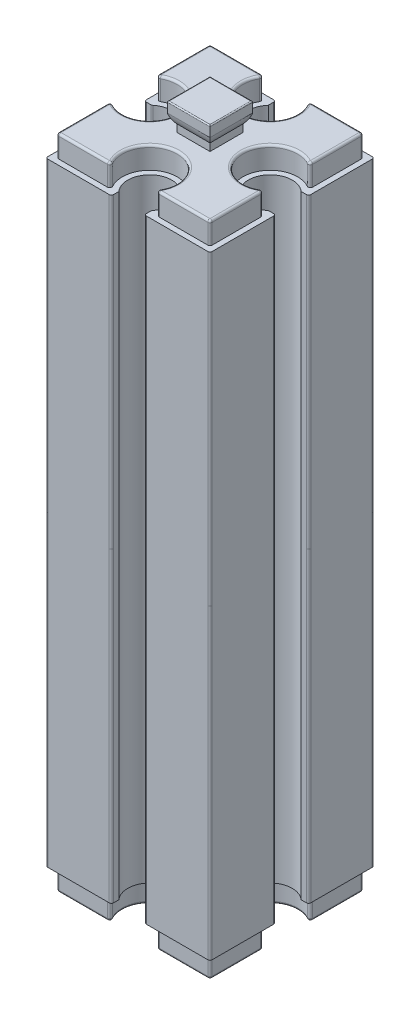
SolidWorks part; units mm, degrees
ref_plane "前视基准面" through (0, 0, 0) normal (0, 0, 1) x (1, 0, 0)
ref_plane "上视基准面" through (0, 0, 0) normal (0, 1, 0) x (1, 0, 0)
ref_plane "右视基准面" through (0, 0, 0) normal (1, 0, 0) x (0, 0, -1)
sketch "草图1" plane through (0, 0, 0) normal (0, 1, 0) x (1, 0, 0)
  line L0 (0, 0) -> (0, 7.5) construction
  line L1 (0, 0) -> (7.5, 0) construction
  line L2 (-7.5, 7.5) -> (-1.5, 7.5)
  line L3 (7.5, 7.5) -> (7.5, 1.5)
  line L4 (6.8229, 1.5) -> (7.5, 1.5)
  line L5 (6.8229, -1.5) -> (7.5, -1.5)
  line L6 (0, 7.5) -> (0, 5.5) construction
  line L7 (-1.5, 6.8229) -> (-1.5, 7.5)
  line L8 (1.5, 6.8229) -> (1.5, 7.5)
  line L9 (1.5, 7.5) -> (7.5, 7.5)
  line L10 (7.5, -1.5) -> (7.5, -7.5)
  line L11 (7.5, -7.5) -> (1.5, -7.5)
  line L12 (1.5, -6.8229) -> (1.5, -7.5)
  line L13 (-1.5, -6.8229) -> (-1.5, -7.5)
  line L14 (-1.5, -7.5) -> (-7.5, -7.5)
  line L15 (-7.5, -7.5) -> (-7.5, -1.5)
  line L16 (-6.8229, -1.5) -> (-7.5, -1.5)
  line L17 (-6.8229, 1.5) -> (-7.5, 1.5)
  line L18 (-7.5, 1.5) -> (-7.5, 7.5)
  arc A0 (-1.5, 6.8229) -> (1.5, 6.8229) centre (0, 5.5) ccw
  arc A1 (6.8229, 1.5) -> (6.8229, -1.5) centre (5.5, 0) ccw
  arc A2 (1.5, -6.8229) -> (-1.5, -6.8229) centre (0, -5.5) ccw
  arc A3 (-6.8229, -1.5) -> (-6.8229, 1.5) centre (-5.5, 0) ccw
  point P36 (0, 0)
  dimension "D6" = 4
  dimension "D7" = 2
  dimension "D1" = 7.5
  dimension "D2" = 7.5
  dimension "D3" = 2
  dimension "D4" = 7.5
  dimension "D5" = 1.5
extrude "凸台-拉伸1" add sketch "草图1" along normal blind 28
sketch "草图2" plane through (0, 28, 0) normal (0, 1, 0) x (1, 0, 0)
  line L0 (-7, 7) -> (-7, 2)
  line L1 (-7, 2) -> (-7, 2)
  line L2 (-7, -2) -> (-7, -2)
  line L3 (-7, -2) -> (-7, -7)
  line L4 (-7, -7) -> (-2, -7)
  line L5 (-2, -7) -> (-2, -7)
  line L6 (2, -7) -> (2, -7)
  line L7 (2, -7) -> (7, -7)
  line L8 (7, -7) -> (7, -2)
  line L9 (7, -2) -> (7, -2)
  line L10 (7, 2) -> (7, 2)
  line L11 (7, 2) -> (7, 7)
  line L12 (7, 7) -> (2, 7)
  line L13 (2, 7) -> (2, 7)
  line L14 (-2, 7) -> (-2, 7)
  line L15 (-2, 7) -> (-7, 7)
  line L16 (-7.5, 7.5) -> (-7.5, 1.5)
  line L17 (-7.5, 1.5) -> (-6.8229, 1.5)
  line L18 (-6.8229, -1.5) -> (-7.5, -1.5)
  line L19 (-7.5, -1.5) -> (-7.5, -7.5)
  line L20 (-7.5, -7.5) -> (-1.5, -7.5)
  line L21 (-1.5, -7.5) -> (-1.5, -6.8229)
  line L22 (1.5, -6.8229) -> (1.5, -7.5)
  line L23 (1.5, -7.5) -> (7.5, -7.5)
  line L24 (7.5, -7.5) -> (7.5, -1.5)
  line L25 (7.5, -1.5) -> (6.8229, -1.5)
  line L26 (6.8229, 1.5) -> (7.5, 1.5)
  line L27 (7.5, 1.5) -> (7.5, 7.5)
  line L28 (7.5, 7.5) -> (1.5, 7.5)
  line L29 (1.5, 7.5) -> (1.5, 6.8229)
  line L30 (-1.5, 6.8229) -> (-1.5, 7.5)
  line L31 (-1.5, 7.5) -> (-7.5, 7.5)
  line L32 (-7.5, 7.5) -> (-7.5, 1.5) construction
  line L33 (-7.5, 1.5) -> (-6.8229, 1.5) construction
  line L34 (-6.8229, -1.5) -> (-7.5, -1.5) construction
  line L35 (-7.5, -1.5) -> (-7.5, -7.5) construction
  line L36 (-7.5, -7.5) -> (-1.5, -7.5) construction
  line L37 (-1.5, -7.5) -> (-1.5, -6.8229) construction
  line L38 (1.5, -6.8229) -> (1.5, -7.5) construction
  line L39 (1.5, -7.5) -> (7.5, -7.5) construction
  line L40 (7.5, -7.5) -> (7.5, -1.5) construction
  line L41 (7.5, -1.5) -> (6.8229, -1.5) construction
  line L42 (6.8229, 1.5) -> (7.5, 1.5) construction
  line L43 (7.5, 1.5) -> (7.5, 7.5) construction
  line L44 (7.5, 7.5) -> (1.5, 7.5) construction
  line L45 (1.5, 7.5) -> (1.5, 6.8229) construction
  line L46 (-1.5, 6.8229) -> (-1.5, 7.5) construction
  line L47 (-1.5, 7.5) -> (-7.5, 7.5) construction
  arc A0 (-7, -2) -> (-7, 2) centre (-5.5, 0) ccw
  arc A1 (2, -7) -> (-2, -7) centre (0, -5.5) ccw
  arc A2 (7, 2) -> (7, -2) centre (5.5, 0) ccw
  arc A3 (-2, 7) -> (2, 7) centre (0, 5.5) ccw
  arc A4 (-6.8229, -1.5) -> (-6.8229, 1.5) centre (-5.5, 0) ccw
  arc A5 (1.5, -6.8229) -> (-1.5, -6.8229) centre (0, -5.5) ccw
  arc A6 (6.8229, 1.5) -> (6.8229, -1.5) centre (5.5, 0) ccw
  arc A7 (-1.5, 6.8229) -> (1.5, 6.8229) centre (0, 5.5) ccw
  arc A8 (-6.8229, -1.5) -> (-6.8229, 1.5) centre (-5.5, 0) ccw construction
  arc A9 (1.5, -6.8229) -> (-1.5, -6.8229) centre (0, -5.5) ccw construction
  arc A10 (6.8229, 1.5) -> (6.8229, -1.5) centre (5.5, 0) ccw construction
  arc A11 (-1.5, 6.8229) -> (1.5, 6.8229) centre (0, 5.5) ccw construction
  dimension "D1" = 0
  dimension "D2" = 0.5
extrude "凸台-拉伸2" add sketch "草图2" along normal blind 2
sketch "草图3" plane through (0, 0, 0) normal (1, 0, 0) x (0, 0, -1)
  line L0 (0, 30) -> (0, 32) construction
  line L1 (2.5, 30) -> (-2.5, 30) construction
  line L2 (0, 32) -> (0, 32.5) construction
  line L3 (-1.5, 30) -> (1.5, 30)
  line L4 (1.5, 30) -> (1.5, 30.6771)
  line L5 (-1.95, 32.5) -> (1.95, 32.5)
  line L6 (1.95, 32.5) -> (1.95, 31.5556)
  line L7 (-1.5, 30) -> (-1.5, 30.6771)
  line L8 (-1.95, 32.5) -> (-1.95, 31.5556)
  arc A0 (-1.5, 30.6771) -> (-1.95, 31.5556) centre (0, 32) cw
  arc A1 (1.5, 30.6771) -> (1.95, 31.5556) centre (0, 32) ccw
  dimension "D5" = 2
  dimension "D1" = 2
  dimension "D2" = 0.5
  dimension "D3" = 1.5
  dimension "D4" = 1.95
extrude "凸台-拉伸3" add sketch "草图3" along normal blind 2 and the other way blind 2
sketch "草图4" plane through (0, 0, 0) normal (0, 0, 1) x (1, 0, 0)
  line L0 (0, 30) -> (0, 32) construction
  line L2 (-2, 30) -> (2, 30) construction
  line L3 (0, 32) -> (0, 32.5) construction
  line L4 (-2, 32.5) -> (2, 32.5) construction
  line L5 (1.95, 32.5) -> (2, 32.5)
  line L6 (-1.95, 32.5) -> (-1.95, 31.5556)
  line L9 (-1.5, 30) -> (-1.5, 30.6771)
  line L10 (1.5, 30) -> (1.5, 30.6771)
  line L11 (1.95, 32.5) -> (1.95, 31.5556)
  line L12 (1.5, 30) -> (2, 30)
  line L13 (-2, 32.5) -> (-1.95, 32.5)
  line L14 (-2, 32.5) -> (-2, 30)
  line L15 (-2, 30) -> (-1.5, 30)
  line L16 (2, 32.5) -> (2, 30)
  arc A0 (-1.95, 31.5556) -> (-1.5, 30.6771) centre (0, 32) ccw
  arc A1 (1.95, 31.5556) -> (1.5, 30.6771) centre (0, 32) cw
  dimension "D1" = 2
  dimension "D2" = 1.5
  dimension "D3" = 1.95
fillet "圆角3" radius 0.2 13 edges at (-1.5, 14, -7.5) (1.5, 14, -7.5) (7.5, 14, -7.5) (7.5, 14, -1.5) (7.5, 14, 1.5) (7.5, 14, 7.5) (-1.5, 14, 7.5) (1.5, 14, 7.5) (-6.8229, 14, -1.5) (-7.5, 14, 7.5) (-7.5, 14, 1.5) (-7.5, 14, -1.5) (-7.5, 14, -7.5)
extrude "切除-拉伸1" cut sketch "草图4" against normal blind 3 and the other way blind 3
fillet "圆角4" radius 0.2 24 edges at (0, 30, 3) (-3, 30, 0) (0, 30, -3) (3, 30, 0) (7, 29, 2) (7, 29, -2) (2, 29, -7) (-2, 29, -7) (-7, 29, 2) (-7, 29, -2) (2, 29, 7) (-2, 29, 7) (7, 29, 7) (4.5, 30, 7) (7, 30, 4.5) (7, 30, -4.5) (7, 29, -7) (4.5, 30, -7) (-4.5, 30, -7) (-7, 29, -7) (-7, 30, -4.5) (-4.5, 30, 7) (-7, 30, 4.5) (-7, 29, 7)
fillet "圆角5" radius 0.1 4 edges at (0, 32.5, -1.95) (1.95, 32.5, 0) (0, 32.5, 1.95) (-1.95, 32.5, 0)
mirror "镜向1" of "圆角5", "圆角4", "切除-拉伸1", "圆角3", "凸台-拉伸3", "凸台-拉伸2", "凸台-拉伸1"
